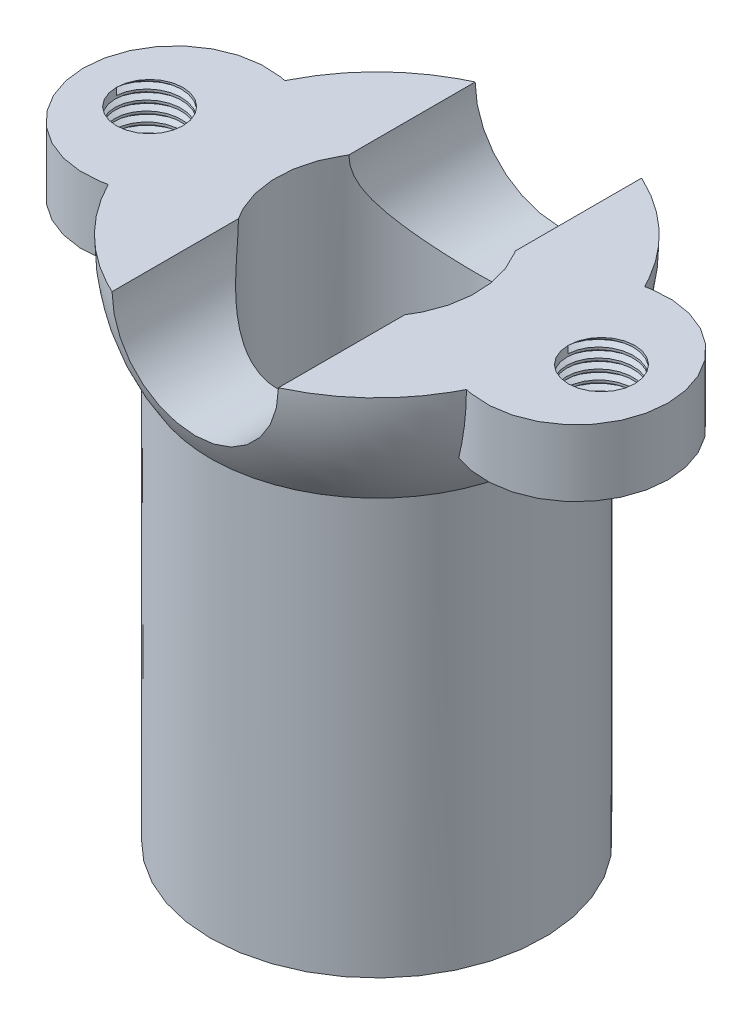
SolidWorks part; units mm, degrees
ref_plane "Front Plane" through (0, 0, 0) normal (0, 0, 1) x (1, 0, 0)
ref_plane "Top Plane" through (0, 0, 0) normal (0, 1, 0) x (1, 0, 0)
ref_plane "Right Plane" through (0, 0, 0) normal (1, 0, 0) x (0, 0, -1)
sketch "Sketch2" plane through (0, 0, 0) normal (0, 0, 1) x (1, 0, 0)
  line L0 (0, 19.05) -> (0, -19.05)
  arc A0 (0, 19.05) -> (0, -19.05) centre (0, 0) cw
  point P4 (0, 0)
  dimension "D1" = 38.1
revolve "Revolve1" add sketch "Sketch2" angle 360 about L0
sketch "Sketch3" plane through (0, 0, 0) normal (0, 1, 0) x (1, 0, 0)
  circle A0 centre (0, 0) radius 15.875
  dimension "D1" = 31.75
extrude "Boss-Extrude1" add sketch "Sketch3" against normal blind 50.165
sketch "Sketch4" plane through (0, 0, 0) normal (0, 0, 1) x (1, 0, 0)
  line L1 (-19.05, 0) -> (19.05, 0)
  line L2 (-19.05, 0) -> (-19.05, 19.05)
  line L3 (-19.05, 19.05) -> (19.05, 19.05)
  line L4 (19.05, 0) -> (19.05, 19.05)
  line L5 (-19.05, 0) -> (19.05, 19.05) construction
  line L6 (-19.05, 19.05) -> (19.05, 0) construction
  arc A0 (15.875, -10.5303) -> (-15.875, -10.5303) centre (0, 0) ccw construction
  point P4 (0, 9.525)
  dimension "D1" = 9.525
extrude "Cut-Extrude1" cut sketch "Sketch4" against normal mid plane 38.1
sketch "Sketch5" plane through (0, 0, 0) normal (0, 0, 1) x (1, 0, 0)
  line L0 (19.05, 0) -> (-19.05, 0) construction
  circle A0 centre (0, 0) radius 7.9375
  dimension "D1" = 15.875
extrude "Cut-Extrude2" cut sketch "Sketch5" against normal mid plane 38.1
sketch "Sketch8" plane through (0, 0, 0) normal (0, 1, 0) x (1, 0, 0)
  circle A0 centre (19.05, 0) radius 8.7312
  arc A1 (7.9375, -17.3176) -> (7.9375, 17.3176) centre (0, 0) ccw construction
  circle A2 centre (-19.0493, -0.1623) radius 8.7312
  arc A3 (-7.9375, 17.3176) -> (-7.9375, -17.3176) centre (0, 0) ccw construction
  dimension "D1" = 17.4625
  dimension "D2" = 17.4625
  dimension "D3" = 19.0493
extrude "Boss-Extrude3" add sketch "Sketch8" against normal blind 6.35
ref_plane "Plane2" through (0, -50.165, 0) normal (0, -1, 0) x (-1, 0, 0)
sketch "Sketch9" plane through (0, -50.165, 0) normal (0, -1, 0) x (-1, 0, 0)
  circle A0 centre (0, 0) radius 9.525
  dimension "D1" = 19.05
sketch "Sketch12" plane through (0, 0, 0) normal (0, 1, 0) x (1, 0, 0)
  line L0 (-27.7802, -0.2367) -> (-21.4302, -0.2367) construction
  line L1 (27.7812, 0) -> (21.4312, 0) construction
  arc A0 (-17.1209, 8.3533) -> (-16.9761, -8.6438) centre (-19.0493, -0.1623) ccw construction
  arc A1 (17.0491, -8.4989) -> (17.0491, 8.4989) centre (19.05, 0) ccw construction
  circle A2 centre (-21.4302, -0.2367) radius 3.175
  circle A3 centre (21.4312, 0) radius 3.175
  point P16 (21.4312, 0)
  dimension "D1" = 6.35
  dimension "D2" = 6.35
  dimension "D3" = 6.35
extrude "Cut-Extrude3" cut sketch "Sketch9" against normal blind 50.165 contours A0
extrude "Cut-Extrude6" cut sketch "Sketch12" against normal blind 17.78 contours A2 | A3
thread "Thread1" pitch 1.5875 start angle 0, offset 0, length 25.4, pitch 1.5875, diameter 19.05
ref_plane "Plane3" through (9.525, -50.165, 0) normal (0, 0, 1) x (1, 0, 0)
sketch "Thread Profile1" plane through (9.525, -50.165, 0) normal (0, 0, 1) x (1, 0, 0)
  line L0 (0, 0) -> (0, 1.5875) construction
  line L1 (0, 0) -> (0.8593, 0.4961)
  line L2 (0.8593, 0.4961) -> (0.8593, 0.6945)
  line L3 (0.8593, 0.6945) -> (0, 1.1906)
  line L4 (0.8593, 0.5953) -> (0, 0.5953) construction
  line L11 (0, 0) -> (0, 1.1906)
  point P2 (0, 0)
  dimension "Pitch" = 1.5875
  dimension "Profile_Angle" = 60
  dimension "Profile_Land" = 0.1984
  dimension "Profile_Height" = 0.8593
thread "Thread2" pitch 0.9071 start angle 0, offset 0, length 6.35, pitch 0.9071, diameter 6.35
ref_plane "Plane4" through (18.2562, 0, 0) normal (0, 0, 1) x (-1, 0, 0)
sketch "Thread Profile2" plane through (18.2562, 0, 0) normal (0, 0, 1) x (-1, 0, 0)
  line L0 (0, 0) -> (0, 0.9071) construction
  line L1 (0, 0) -> (0.491, 0.2835)
  line L2 (0.491, 0.2835) -> (0.491, 0.3969)
  line L3 (0.491, 0.3969) -> (0, 0.6804)
  line L4 (0.491, 0.3402) -> (0, 0.3402) construction
  line L11 (0, 0) -> (0, 0.6804)
  point P2 (0, 0)
  dimension "Pitch" = 0.9071
  dimension "Profile_Angle" = 60
  dimension "Profile_Land" = 0.1134
  dimension "Profile_Height" = 0.491
thread "Thread3" pitch 0.9071 start angle 0, offset 0, length 6.35, pitch 0.9071, diameter 6.35
ref_plane "Plane6" through (-24.6052, 0, 0.2367) normal (0, 0, 1) x (-1, 0, 0)
sketch "Thread Profile4" plane through (-24.6052, 0, 0.2367) normal (0, 0, 1) x (-1, 0, 0)
  line L0 (0, 0) -> (0, 0.9071) construction
  line L1 (0, 0) -> (0.491, 0.2835)
  line L2 (0.491, 0.2835) -> (0.491, 0.3969)
  line L3 (0.491, 0.3969) -> (0, 0.6804)
  line L4 (0.491, 0.3402) -> (0, 0.3402) construction
  line L11 (0, 0) -> (0, 0.6804)
  point P2 (0, 0)
  dimension "Pitch" = 0.9071
  dimension "Profile_Angle" = 60
  dimension "Profile_Land" = 0.1134
  dimension "Profile_Height" = 0.491
